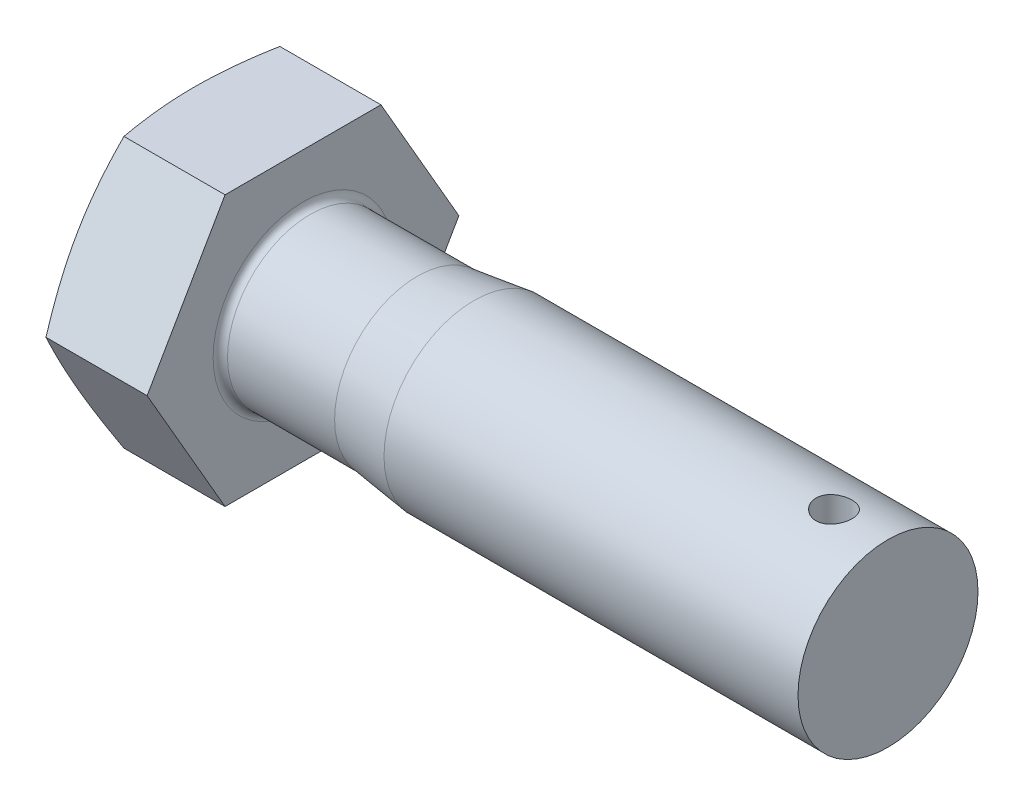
SolidWorks part; units mm, degrees
ref_plane "Front" through (0, 0, 0) normal (0, 0, 1) x (1, 0, 0)
ref_plane "Top" through (0, 0, 0) normal (0, 1, 0) x (1, 0, 0)
ref_plane "Right" through (0, 0, 0) normal (1, 0, 0) x (0, 0, -1)
sketch "Sketch1" plane through (0, 0, 0) normal (1, 0, 0) x (0, 0, -1)
  line L1 (8.6603, -15) -> (17.3205, 0)
  line L2 (17.3205, 0) -> (8.6603, 15)
  line L3 (8.6603, 15) -> (-8.6603, 15)
  line L4 (-8.6603, 15) -> (-17.3205, 0)
  line L5 (-17.3205, 0) -> (-8.6603, -15)
  line L6 (-8.6603, -15) -> (8.6603, -15)
  circle A0 centre (0, 0) radius 15 construction
  dimension "s" = 30
extrude "BaseHead" add sketch "Sketch1" along normal blind 12.5
ref_plane "Plane1" through (31.5, 0, 0) normal (1, 0, 0) x (0, 0, -1)
sketch "Sketch2" plane through (12.5, 0, 0) normal (1, 0, 0) x (0, 0, -1)
  circle A0 centre (0, 0) radius 10
  dimension "d" = 20
extrude "BaseBody" add sketch "Sketch2" along normal blind 65
sketch "Sketch3" plane through (3.1612, 0, 2.6123) normal (0, 1, 0) x (0, 0, -1)
  line L0 (2.6123, 2.0714) -> (2.6123, -1.5224) construction
  line L2 (19.9328, 3.1612) -> (19.9328, 1.8981)
  line L3 (19.9328, 1.8981) -> (16.4623, 3.1612)
  line L5 (16.4623, 3.1612) -> (19.9328, 3.1612)
  dimension "D1" = 20
  dimension "dw" = 27.7
revolve "HeadChamfer" cut sketch "Sketch3" angle 360 about L0
sketch "Sketch4" plane through (0, 0, 0) normal (1, 0, 0) x (0, 0, -1)
  circle A0 centre (0, 0) radius 11.2
  dimension "da" = 22.4
extrude "Cut-Extrude1" cut sketch "Sketch4" along normal blind 2.5
sketch "Sketch5" plane through (-2.9296, 0, 7.9296) normal (0, 1, 0) x (0, 0, -1)
  line L0 (7.9296, -2.9296) -> (7.9296, -19.1832) construction
  line L1 (25.2501, -15.4296) -> (16.5899, -15.4296) construction
  line L2 (17.9296, -34.4296) -> (17.1176, -28.1296)
  line L3 (10.9296, -2.9296) -> (10.9296, -19.1832) construction
  line L4 (17.1176, -28.1296) -> (17.1176, -15.4296)
  line L5 (17.9296, -80.4296) -> (17.9296, -15.4296) construction
  line L6 (17.1176, -15.4296) -> (26.3056, -15.4296)
  line L7 (26.3056, -15.4296) -> (26.3056, -34.4296)
  line L8 (26.3056, -34.4296) -> (17.9296, -34.4296)
  line L9 (-2.0704, -80.4296) -> (17.9296, -80.4296) construction
  dimension "D1" = 3
  dimension "ds" = 18.376
  dimension "x" = 6.3
  dimension "D3" = 46
  dimension "D4" = 36.752
revolve "Cut-Revolve1" cut sketch "Sketch5" angle 360 about L0
fillet "HeadFillet" radius 0.8 1 edges at (12.5, 0, 9.188)
sketch "Sketch6" plane through (0, 0, 0) normal (0, 1, 0) x (1, 0, 0)
  line L0 (12.5, -8.6603) -> (12.5, -17.3205) construction
  circle A0 centre (71.5, 0) radius 2
  dimension "d1" = 4
  dimension "lh" = 59
extrude "Hole" cut sketch "Sketch6" against normal through all and the other way through all
equation "\"D1@Cut-Extrude1\" = 0.2 * \"k@BaseHead\""
equation "\"b@ThreadCosmetic1\" = \"l@BaseBody\" - \"lg@Plane1\""
equation "\"D4@Sketch5\" = 2 * \"ds@Sketch5\""
equation "\"D3@Sketch5\" = \"l@BaseBody\" - \"lg@Plane1\""
